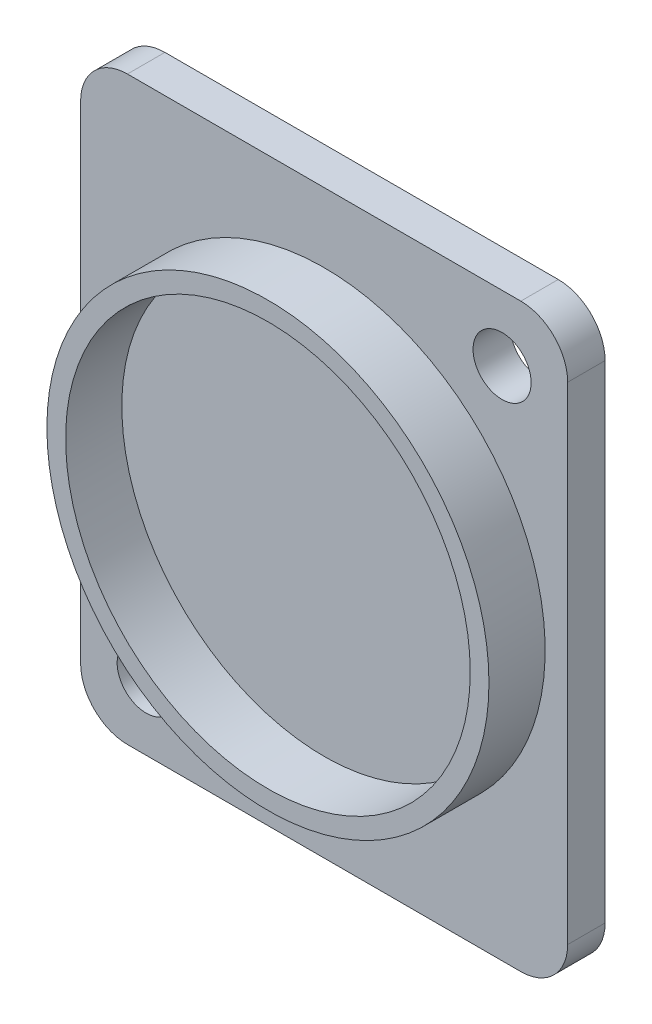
SolidWorks part; units mm, degrees
ref_plane "Front Plane" through (0, 0, 0) normal (0, 0, 1) x (1, 0, 0)
ref_plane "Top Plane" through (0, 0, 0) normal (0, 1, 0) x (1, 0, 0)
ref_plane "Right Plane" through (0, 0, 0) normal (1, 0, 0) x (0, 0, -1)
sketch "Sketch1" plane through (0, 0, 0) normal (0, 0, 1) x (1, 0, 0)
  line L1 (10.5, -15.5) -> (-10.5, -15.5)
  line L2 (13, -13) -> (13, 13)
  line L3 (10.5, 15.5) -> (-10.5, 15.5)
  line L4 (-13, -13) -> (-13, 13)
  line L5 (13, -15.5) -> (-13, 15.5) construction
  line L6 (13, 15.5) -> (-13, -15.5) construction
  arc A0 (-10.5, -15.5) -> (-13, -13) centre (-10.5, -13) cw
  arc A1 (10.5, -15.5) -> (13, -13) centre (10.5, -13) ccw
  arc A2 (13, 13) -> (10.5, 15.5) centre (10.5, 13) ccw
  arc A3 (-10.5, 15.5) -> (-13, 13) centre (-10.5, 13) ccw
  circle A4 centre (9.5, 12) radius 1.55
  circle A5 centre (-9.5, -12) radius 1.55
  point P0 (0, 0)
  dimension "D3" = 2.5
  dimension "D4" = 3.1
  dimension "D1" = 26
  dimension "D2" = 31
  dimension "D5" = 19
  dimension "D6" = 24
  dimension "D7" = 9.5
  dimension "D8" = 12
extrude "Boss-Extrude1" add sketch "Sketch1" along normal blind 2
sketch "Sketch2" plane through (0, 0, 2) normal (0, 0, 1) x (1, 0, 0)
  circle A0 centre (0, 0) radius 11.8
  circle A1 centre (0, 0) radius 10.8
  dimension "D1" = 23.6
  dimension "D2" = 1
extrude "Boss-Extrude2" add sketch "Sketch2" along normal blind 3
